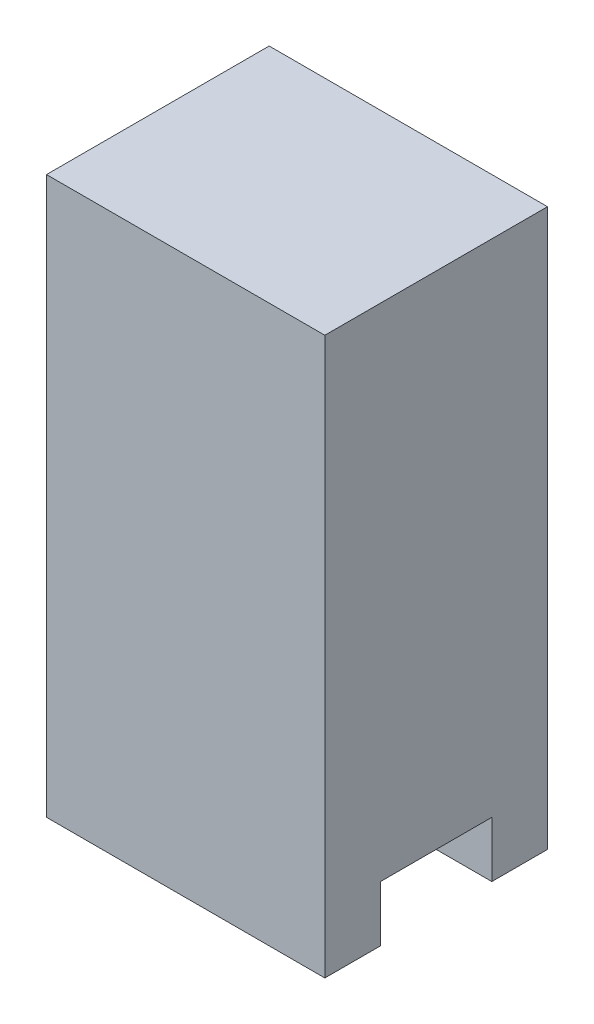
SolidWorks part; units mm, degrees
ref_plane "Plan1" through (0, 0, 0) normal (0, 0, 1) x (1, 0, 0)
ref_plane "Plan2" through (0, 0, 0) normal (0, 1, 0) x (1, 0, 0)
ref_plane "Plan3" through (0, 0, 0) normal (1, 0, 0) x (0, 0, -1)
sketch "Esquisse1" plane through (0, 0, 0) normal (0, 0, 1) x (1, 0, 0)
  line L1 (0, 0) -> (50, 0)
  line L2 (0, 0) -> (0, 100)
  line L3 (0, 100) -> (50, 100)
  line L4 (50, 0) -> (50, 100)
extrude "Base-Extrusion" add sketch "Esquisse1" along normal blind 40
sketch "Esquisse2" plane through (0, 0, 0) normal (0, -1, 0) x (1, 0, 0)
  line L0 (50, 40) -> (50, 0) construction
  line L1 (50, 30) -> (0, 30)
  line L2 (50, 30) -> (50, 10)
  line L3 (50, 10) -> (0, 10)
  line L4 (0, 30) -> (0, 10)
  line L5 (0, 40) -> (0, 0) construction
  line L6 (0, 0) -> (50, 0) construction
  dimension "D1" = 10
  dimension "D2" = 20
extrude "Enlèv. mat.-Extru.1" cut sketch "Esquisse2" against normal blind 10
